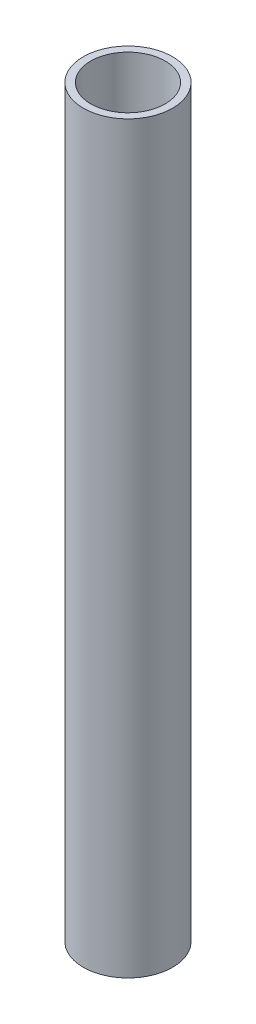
SolidWorks part; units mm, degrees
ref_plane "Front Plane" through (0, 0, 0) normal (0, 0, 1) x (1, 0, 0)
ref_plane "Top Plane" through (0, 0, 0) normal (0, 1, 0) x (1, 0, 0)
ref_plane "Right Plane" through (0, 0, 0) normal (1, 0, 0) x (0, 0, -1)
sketch "Sketch2" plane through (0, 0, 0) normal (0, 1, 0) x (1, 0, 0)
  circle A0 centre (0, 0) radius 30.48
  circle A1 centre (0, 0) radius 25.4
  dimension "D1" = 50.8
  dimension "D2" = 60.96
extrude "Boss-Extrude1" add sketch "Sketch2" along normal blind 508
